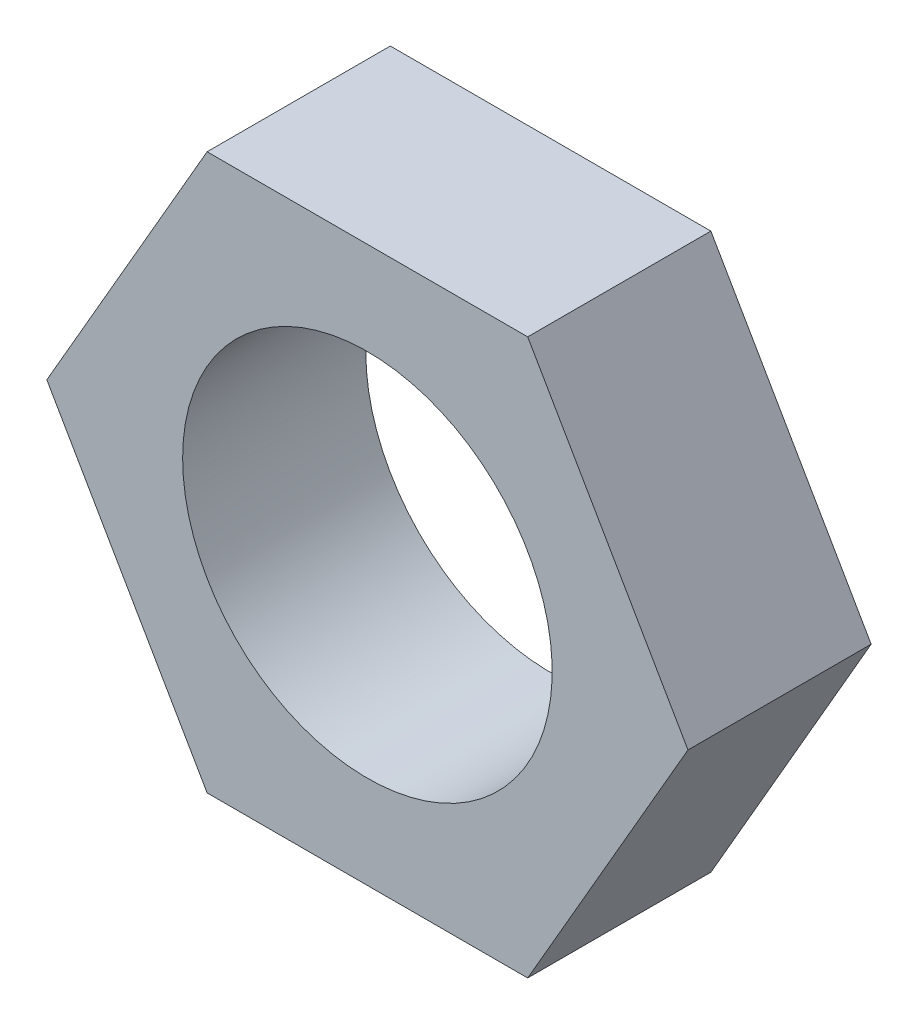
SolidWorks part; units mm, degrees
ref_plane "Front Plane" through (0, 0, 0) normal (0, 0, 1) x (1, 0, 0)
ref_plane "Top Plane" through (0, 0, 0) normal (0, 1, 0) x (1, 0, 0)
ref_plane "Right Plane" through (0, 0, 0) normal (1, 0, 0) x (0, 0, -1)
ref_plane "Plane1" through (0, 0, 12.7) normal (0, 0, 1) x (1, 0, 0)
sketch "Sketch1" plane through (0, 0, 12.7) normal (0, 0, 1) x (1, 0, 0)
  line L0 (11.1125, -19.2474) -> (22.225, 0)
  line L1 (22.225, 0) -> (11.1125, 19.2474)
  line L2 (11.1125, 19.2474) -> (-11.1125, 19.2474)
  line L3 (-11.1125, 19.2474) -> (-22.225, 0)
  line L4 (-22.225, 0) -> (-11.1125, -19.2474)
  line L5 (-11.1125, -19.2474) -> (11.1125, -19.2474)
  circle A0 centre (0, 0) radius 12.8107
extrude "Boss-Extrude1" add sketch "Sketch1" against normal blind 12.7
